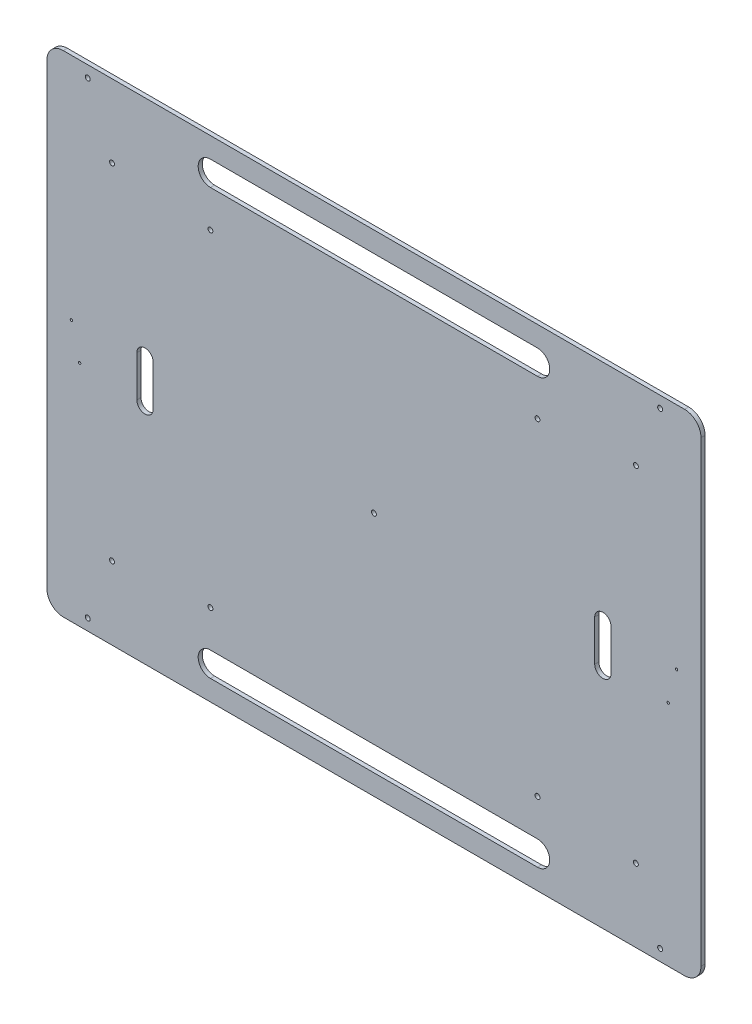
SolidWorks part; units mm, degrees
ref_plane "Plan de face" through (0, 0, 0) normal (0, 0, 1) x (1, 0, 0)
ref_plane "Plan de dessus" through (0, 0, 0) normal (0, 1, 0) x (1, 0, 0)
ref_plane "Plan de droite" through (0, 0, 0) normal (1, 0, 0) x (0, 0, -1)
sketch "Esquisse2" plane through (0, 0, 0) normal (0, 0, 1) x (1, 0, 0)
  line L0 (0, 0) -> (-800, 0) construction
  line L6 (0, 300) -> (0, -300)
  line L7 (-800, 300) -> (-800, -300)
  line L13 (0, 300) -> (-800, 300)
  line L14 (-800, -300) -> (0, -300)
  dimension "D1" = 800
  dimension "D2" = 600
extrude "Boss.-Extru.1" add sketch "Esquisse2" along normal blind 5
sketch "Esquisse3" plane through (0, 0, 5) normal (0, 0, 1) x (1, 0, 0)
  line L0 (-96.9863, -69.718) -> (-82.7363, -69.718) construction
  line L2 (-96.9863, -58.718) -> (-96.9863, -80.718) construction
  circle A0 centre (-96.9863, -69.718) radius 11
  circle A1 centre (-82.7363, -69.718) radius 1
  circle A2 centre (-111.2363, -69.718) radius 1
  dimension "D3" = 2
  dimension "D1" = 22
  dimension "D2" = 14.25
fillet "Congé1" radius 20 4 edges at (-800, -300, 2.5) (0, -300, 2.5) (0, 300, 2.5) (-800, 300, 2.5)
sketch "Esquisse10" plane through (0, 0, 5) normal (0, 0, 1) x (1, 0, 0)
  line L0 (-400, 300) -> (-400, -300) construction
  line L1 (-20, 300) -> (-780, 300) construction
  line L2 (-780, -300) -> (-20, -300) construction
  line L3 (-800, 0) -> (0, 0) construction
  line L4 (-800, 280) -> (-800, -280) construction
  circle A1 centre (-760, -20.86) radius 1.5
  circle A3 centre (-40, -20.86) radius 1.5
  dimension "D1" = 20.86
  dimension "D2" = 3
  dimension "D3" = 40
extrude "Enlèv. mat.-Extru.7" cut sketch "Esquisse10" against normal through all
sketch "Esquisse11" plane through (0, 0, 5) normal (0, 0, 1) x (1, 0, 0)
  line L1 (0, -280) -> (0, 280) construction
  line L2 (-780, -300) -> (-20, -300) construction
  line L3 (-400, 300) -> (-400, -300) construction
  line L4 (-20, 300) -> (-780, 300) construction
  circle A0 centre (-29.9701, 19.6357) radius 1.5
  circle A1 centre (-770.0299, 19.6357) radius 1.5
  point P3 (-400, -300)
  dimension "D1" = 3
  dimension "D2" = 29.9701
  dimension "D3" = 319.6357
extrude "Enlèv. mat.-Extru.8" cut sketch "Esquisse11" against normal through all
sketch "Esquisse12" plane through (0, 0, 5) normal (0, 0, 1) x (1, 0, 0)
  line L0 (-800, 0) -> (0, 0) construction
  line L1 (-800, 280) -> (-800, -280) construction
  line L2 (-680, 25) -> (-680, -25) construction
  line L3 (-670, 25) -> (-670, -25)
  line L4 (-690, 25) -> (-690, -25)
  line L5 (-400, 300) -> (-400, -300) construction
  line L6 (-20, 300) -> (-780, 300) construction
  line L7 (-780, -300) -> (-20, -300) construction
  line L8 (-120, 25) -> (-120, -25) construction
  line L9 (-130, 25) -> (-130, -25)
  line L10 (-110, 25) -> (-110, -25)
  arc A0 (-670, 25) -> (-690, 25) centre (-680, 25) ccw
  arc A1 (-690, -25) -> (-670, -25) centre (-680, -25) ccw
  arc A2 (-130, 25) -> (-110, 25) centre (-120, 25) cw
  arc A3 (-110, -25) -> (-130, -25) centre (-120, -25) cw
  point P7 (-680, 0)
  point P20 (-120, 0)
  dimension "D1" = 50
  dimension "D2" = 20
  dimension "D3" = 120
extrude "Enlèv. mat.-Extru.9" cut sketch "Esquisse12" against normal through all
sketch "Esquisse14" plane through (0, 0, 0) normal (0, 0, -1) x (-1, 0, 0)
  line L0 (780, -300) -> (20, -300) construction
  line L1 (50, 286) -> (750, 286) construction
  line L2 (50, 286) -> (50, -286) construction
  line L3 (50, -286) -> (750, -286) construction
  line L4 (750, 286) -> (750, -286) construction
  line L5 (800, 280) -> (800, -280) construction
  line L6 (20, 300) -> (780, 300) construction
  line L7 (0, -280) -> (0, 280) construction
  circle A0 centre (50, 286) radius 3
  circle A1 centre (50, -286) radius 3
  circle A2 centre (750, -286) radius 3
  circle A3 centre (750, 286) radius 3
  dimension "D5" = 6
  dimension "D6" = 6
  dimension "D7" = 6
  dimension "D8" = 6
  dimension "D1" = 14
  dimension "D2" = 50
  dimension "D3" = 14
  dimension "D4" = 50
extrude "Enlèv. mat.-Extru.10" cut sketch "Esquisse14" against normal through all
sketch "Esquisse15" plane through (0, 0, 5) normal (0, 0, 1) x (1, 0, 0)
  line L0 (-20, 300) -> (-780, 300) construction
  line L1 (-600, 200) -> (-200, 200) construction
  line L2 (-600, 200) -> (-600, -200) construction
  line L3 (-600, -200) -> (-200, -200) construction
  line L4 (-200, 200) -> (-200, -200) construction
  line L5 (-600, 200) -> (-200, -200) construction
  line L6 (-200, 200) -> (-600, -200) construction
  circle A0 centre (-600, 200) radius 3
  circle A1 centre (-200, 200) radius 3
  circle A2 centre (-200, -200) radius 3
  circle A3 centre (-600, -200) radius 3
  circle A4 centre (-400, 0) radius 3
  point P6 (-400, 300)
  point P7 (-400, 200)
  point P8 (-200, 0)
  dimension "D3" = 6
  dimension "D4" = 6
  dimension "D5" = 6
  dimension "D6" = 6
  dimension "D7" = 6
  dimension "D1" = 400
  dimension "D2" = 400
extrude "Enlèv. mat.-Extru.11" cut sketch "Esquisse15" against normal through all
sketch "Esquisse16" plane through (0, 0, 5) normal (0, 0, 1) x (1, 0, 0)
  circle A0 centre (-720.3553, 210.7107) radius 3
  circle A1 centre (-79.6447, 210.7107) radius 3
  circle A2 centre (-79.6447, -210.7107) radius 3
  circle A3 centre (-720.3553, -210.7107) radius 3
  dimension "D1" = 6
  dimension "D2" = 6
  dimension "D3" = 6
  dimension "D4" = 6
extrude "Enlèv. mat.-Extru.12" cut sketch "Esquisse16" against normal through all
sketch "Esquisse17" plane through (0, 0, 5) normal (0, 0, 1) x (1, 0, 0)
  line L0 (-400, 300) -> (-400, -300) construction
  line L1 (-20, 300) -> (-780, 300) construction
  line L2 (-780, -300) -> (-20, -300) construction
  line L3 (-800, 0) -> (0, 0) construction
  line L4 (-800, 280) -> (-800, -280) construction
  line L5 (-600, 260) -> (-200, 260) construction
  line L6 (-600, 275) -> (-200, 275)
  line L7 (-600, 245) -> (-200, 245)
  line L8 (-600, -260) -> (-200, -260) construction
  line L9 (-600, -275) -> (-200, -275)
  line L10 (-600, -245) -> (-200, -245)
  arc A0 (-600, 275) -> (-600, 245) centre (-600, 260) ccw
  arc A1 (-200, 245) -> (-200, 275) centre (-200, 260) ccw
  arc A2 (-600, -275) -> (-600, -245) centre (-600, -260) cw
  arc A3 (-200, -245) -> (-200, -275) centre (-200, -260) cw
  point P13 (-400, 260)
  point P18 (0, 0)
  point P21 (-400, -260)
  dimension "D1" = 15
  dimension "D2" = 400
  dimension "D3" = 40
extrude "Enlèv. mat.-Extru.13" cut sketch "Esquisse17" against normal through all
sketch "Esquisse4" plane through (0, 0, 10) normal (0, 0, 1) x (1, 0, 0)
  line L0 (0, -280) -> (0, 280) construction
  line L1 (-60, 107.3868) -> (-250, 107.3868)
  line L2 (-50, 97.3868) -> (-50, -100.6132)
  line L3 (-60, -110.6132) -> (-250, -110.6132)
  line L4 (-260, 97.3868) -> (-260, -100.6132)
  line L5 (0, 0) -> (-298.744, 0) construction
  arc A0 (-250, -110.6132) -> (-260, -100.6132) centre (-250, -100.6132) cw
  arc A1 (-50, -100.6132) -> (-60, -110.6132) centre (-60, -100.6132) cw
  arc A2 (-60, 107.3868) -> (-50, 97.3868) centre (-60, 97.3868) cw
  arc A3 (-250, 107.3868) -> (-260, 97.3868) centre (-250, 97.3868) ccw
  point P8 (-260, -110.6132)
  point P11 (-50, -110.6132)
  dimension "D3" = 10
  dimension "D1" = 210
  dimension "D2" = 50
  dimension "D4" = 198
extrude "Enlèv. mat.-Extru.2" cut sketch "Esquisse4" against normal blind 1.5 contours L2 A1 L3 A0 L4 A3 L1 A2
sketch "Esquisse7" plane through (0, 0, 8.5) normal (0, 0, 1) x (1, 0, 0)
  line L0 (-90, 33.7224) -> (-90, -36.2776) construction
  line L1 (-50, 97.3868) -> (-50, -100.6132) construction
  text T0 "AMR-X" font "Century Gothic" height 13
  dimension "D1" = 70
  dimension "D2" = 40
extrude "Enlèv. mat.-Extru.3" cut sketch "Esquisse7" against normal blind 2
sketch "Esquisse8" plane through (0, 0, 10) normal (0, 0, 1) x (1, 0, 0)
  line L0 (-96, 107.3868) -> (-96, -119.943) construction
  line L2 (-50, 97.3868) -> (-50, -100.6132) construction
  line L3 (-60, 107.3868) -> (-250, 107.3868) construction
  circle A0 centre (-96, 74.3868) radius 8
  circle A1 centre (-96, 47.3868) radius 8
  dimension "D2" = 16
  dimension "D3" = 16
  dimension "D4" = 27
  dimension "D1" = 46
  dimension "D5" = 33
sketch "Esquisse9" plane through (0, 0, 8.5) normal (0, 0, 1) x (1, 0, 0)
  line L0 (-135.6998, 70.8388) -> (-217.6998, 70.8388)
  line L1 (-217.6998, -74.0612) -> (-217.6998, 70.8388)
  line L2 (-130.6998, -79.0612) -> (-222.6998, -79.0612) construction
  line L3 (-130.6998, -79.0612) -> (-130.6998, 75.8388) construction
  line L4 (-135.6998, -74.0612) -> (-217.6998, -74.0612)
  line L5 (-130.6998, -1.6112) -> (-260, -1.6132) construction
  line L6 (-135.6998, -74.0612) -> (-135.6998, 70.8388)
  line L8 (-260, 97.3868) -> (-260, -100.6132) construction
  line L9 (-222.6998, -79.0612) -> (-222.6998, 75.8388) construction
  line L10 (-130.6998, 75.8388) -> (-222.6998, 75.8388) construction
  circle A0 centre (-222.6998, 75.8388) radius 1.25
  circle A1 centre (-130.6998, 75.8388) radius 1.25
  circle A2 centre (-130.6974, -79.0612) radius 1.25
  circle A3 centre (-222.6974, -79.0641) radius 1.25
  dimension "D2" = 154.9
  dimension "D3" = 2.5
  dimension "D4" = 2.5
  dimension "D5" = 5
  dimension "D1" = 92
extrude "Enlèv. mat.-Extru.4" cut sketch "Esquisse9" against normal blind 10
extrude "Enlèv. mat.-Extru.5" cut sketch "Esquisse8" against normal blind 10
extrude "Enlèv. mat.-Extru.6" cut sketch "Esquisse3" against normal blind 10
